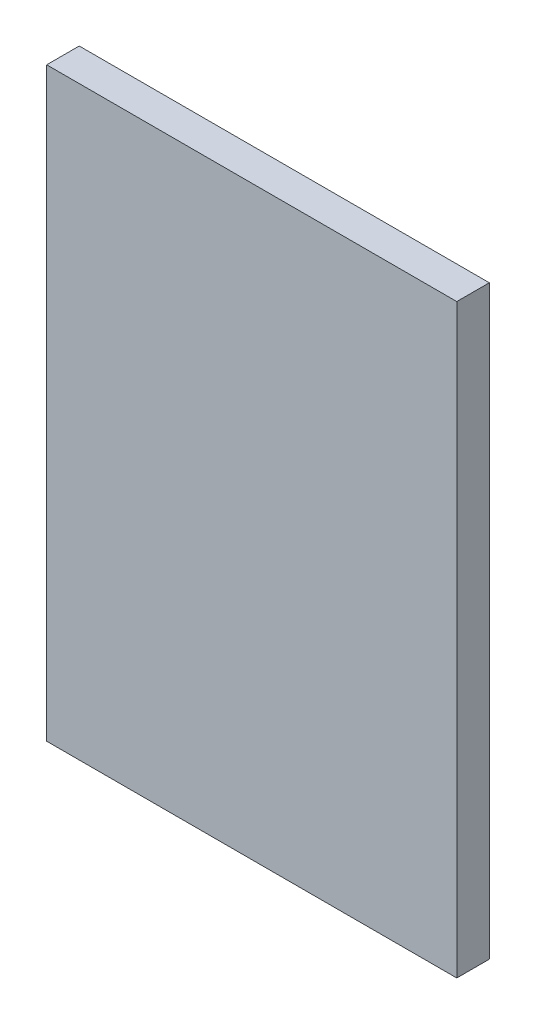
SolidWorks part; units mm, degrees
ref_plane "Plan de face" through (0, 0, 0) normal (0, 0, 1) x (1, 0, 0)
ref_plane "Plan de dessus" through (0, 0, 0) normal (0, 1, 0) x (1, 0, 0)
ref_plane "Plan de droite" through (0, 0, 0) normal (1, 0, 0) x (0, 0, -1)
sketch "Esquisse1" plane through (0, 0, 0) normal (0, 0, 1) x (1, 0, 0)
  line L1 (0, 0) -> (-1260, 0)
  line L2 (0, 0) -> (0, 1800)
  line L3 (0, 1800) -> (-1260, 1800)
  line L4 (-1260, 0) -> (-1260, 1800)
  dimension "D1" = 1800
  dimension "D2" = 1260
extrude "Boss.-Extru.1" add sketch "Esquisse1" against normal blind 100
